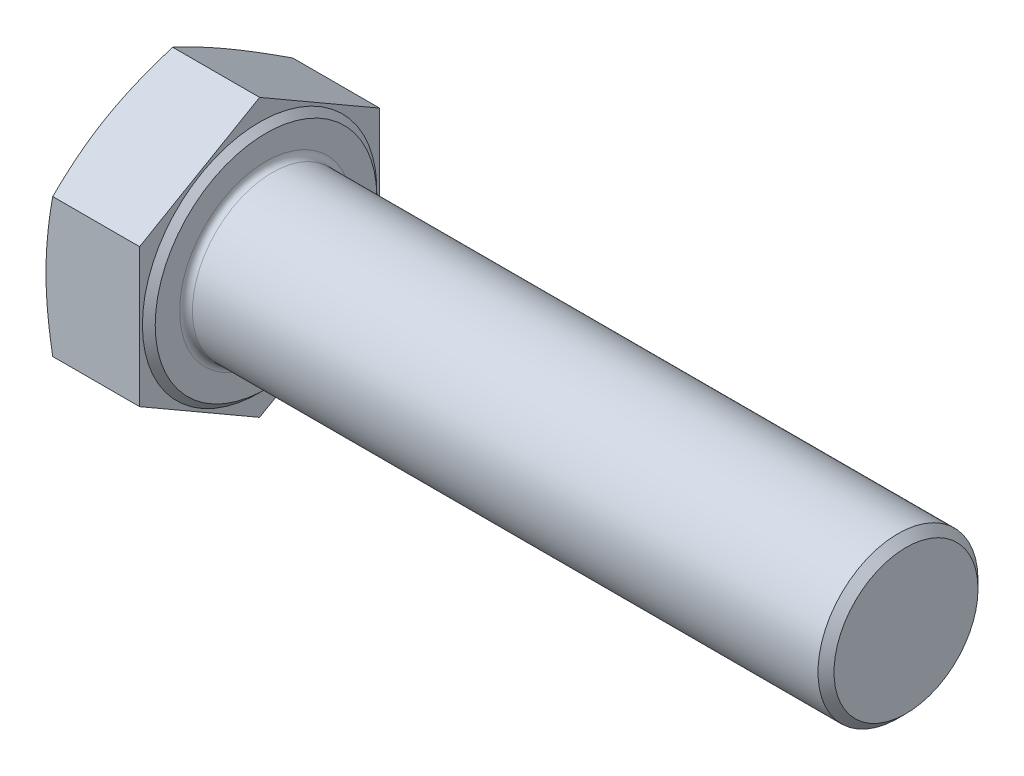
SolidWorks part; units mm, degrees
ref_plane "Front" through (0, 0, 0) normal (0, 0, 1) x (1, 0, 0)
ref_plane "Top" through (0, 0, 0) normal (0, 1, 0) x (1, 0, 0)
ref_plane "Right" through (0, 0, 0) normal (1, 0, 0) x (0, 0, -1)
sketch "Sketch2" plane through (0, 0, 0) normal (1, 0, 0) x (0, 0, -1)
  line L1 (0, -17.3205) -> (15, -8.6603)
  line L2 (15, -8.6603) -> (15, 8.6603)
  line L3 (15, 8.6603) -> (0, 17.3205)
  line L4 (0, 17.3205) -> (-15, 8.6603)
  line L5 (-15, 8.6603) -> (-15, -8.6603)
  line L6 (-15, -8.6603) -> (0, -17.3205)
  circle A0 centre (0, 0) radius 15 construction
  dimension "s" = 30
extrude "BaseHead" add sketch "Sketch2" along normal blind 12.5
sketch "Sketch3" plane through (0, 0, 0) normal (0, 0, 1) x (1, 0, 0)
  line L0 (12.5, 17.3205) -> (12.5, 13.85)
  line L2 (12.5, 13.85) -> (11.7, 14.65)
  line L3 (11.7, 14.65) -> (11.7, 17.3205)
  line L5 (11.7, 17.3205) -> (12.5, 17.3205)
  line L6 (-0.9571, 0) -> (7.6478, 0) construction
  line L7 (12.5, 17.3205) -> (0, 17.3205) construction
  dimension "D1" = 45
  dimension "c" = 0.8
  dimension "dw" = 27.7
revolve "BearingFace" cut sketch "Sketch3" angle 360 about L6
sketch "Sketch4" plane through (0, 0, 0) normal (0, 0, 1) x (1, 0, 0)
  line L0 (-0.4935, 0) -> (3.5626, 0) construction
  line L2 (0, 17.3205) -> (0.8446, 17.3205)
  line L4 (0.8446, 17.3205) -> (0, 15)
  line L6 (0, 15) -> (0, 17.3205)
  line L7 (11.7, 17.3205) -> (0, 17.3205) construction
  dimension "D1" = 20
  dimension "D2" = 30
revolve "HeadChamfer" cut sketch "Sketch4" angle 360 about L0
ref_plane "Plane1" through (46.5, 0, 0) normal (1, 0, 0) x (0, 0, -1)
sketch "Sketch5" plane through (12.5, 0, 0) normal (1, 0, 0) x (0, 0, -1)
  circle A0 centre (0, 0) radius 10
  dimension "d" = 20
extrude "BaseBody" add sketch "Sketch5" along normal blind 80
chamfer "Chamfer1" distance 1 angle 45 1 edges at (92.5, 0, -10)
fillet "HeadFillet" radius 0.8 1 edges at (12.5, 0, -10)
equation "\"D2@Sketch4\" = \"s@Sketch2\""
equation "\"D1@Chamfer1\" = 0.05 * \"d@Sketch5\""
equation "\"D1@ThreadCosmetic1\" = \"l@BaseBody\" - \"lg@Plane1\""
